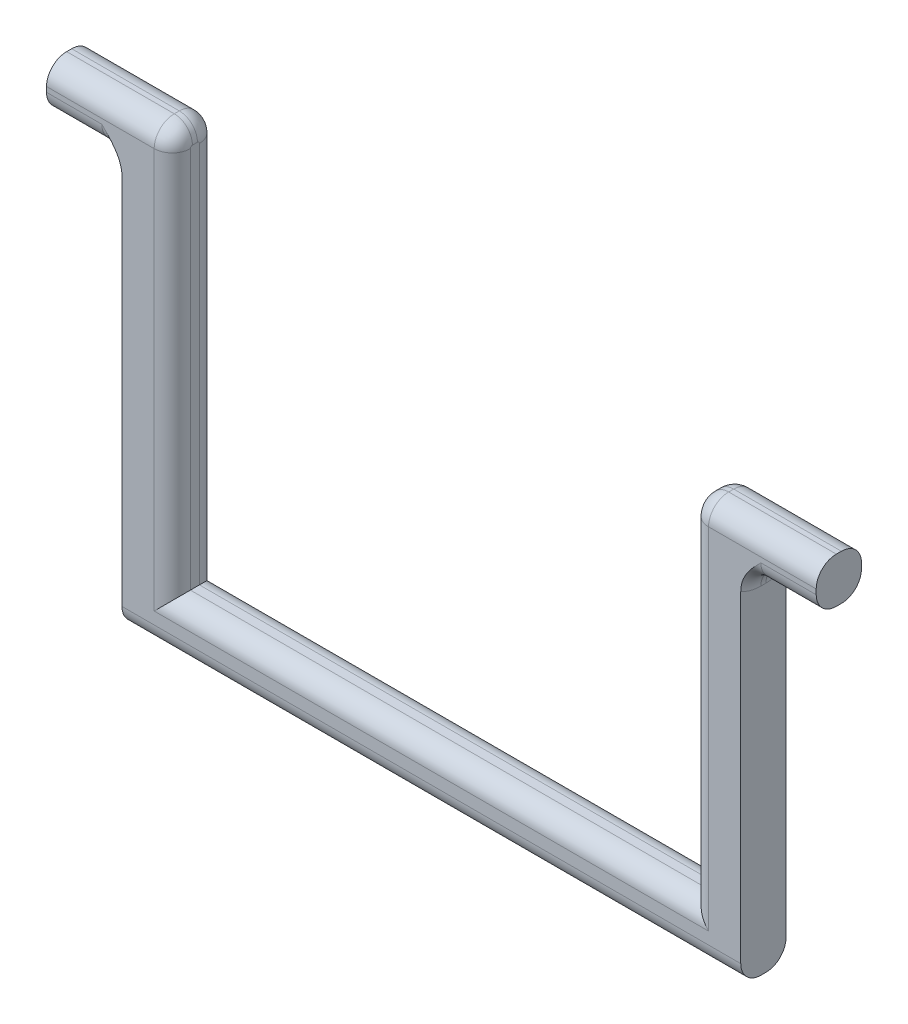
SolidWorks part; units mm, degrees
ref_plane "Front Plane" through (0, 0, 0) normal (0, 0, 1) x (1, 0, 0)
ref_plane "Top Plane" through (0, 0, 0) normal (0, 1, 0) x (1, 0, 0)
ref_plane "Right Plane" through (0, 0, 0) normal (1, 0, 0) x (0, 0, -1)
sketch "Sketch1" plane through (0, 0, 0) normal (0, 0, 1) x (1, 0, 0)
  line L0 (0, 0) -> (0, 11.43)
  line L1 (0, 11.43) -> (31.75, 11.43)
  line L2 (31.75, 11.43) -> (31.75, -90.17)
  line L9 (175.26, -102.87) -> (19.05, -102.87)
  line L10 (19.05, -102.87) -> (19.05, 0)
  line L11 (19.05, 0) -> (0, 0)
  line L13 (162.56, -90.17) -> (31.75, -90.17)
  line L14 (162.56, -90.17) -> (162.56, -1.27)
  line L15 (162.56, -1.27) -> (194.31, -1.27)
  line L16 (194.31, -1.27) -> (194.31, -12.7)
  line L17 (194.31, -12.7) -> (175.26, -12.7)
  line L18 (175.26, -12.7) -> (175.26, -102.87)
  dimension "D1" = 88.9
  dimension "D2" = 11.43
  dimension "1.5" = 31.75
  dimension "D3" = 31.75
  dimension "D4" = 156.21
  dimension "D5" = 12.7
  dimension "D6" = 12.7
  dimension "D7" = 101.6
  dimension ".45" = 11.43
  dimension "D8" = 12.7
extrude "Boss-Extrude1" add sketch "Sketch1" along normal blind 11.43
fillet "Fillet4" radius 5.08 8 edges at (9.525, 0, 11.43) (15.875, 11.43, 0) (15.875, 11.43, 11.43) (9.525, 0, 0) (184.785, -12.7, 0) (184.785, -12.7, 11.43) (178.435, -1.27, 0) (178.435, -1.27, 11.43)
fillet "Fillet5" radius 4.572 12 edges at (31.75, 11.43, 5.715) (31.75, 9.9421, 1.4879) (31.75, 9.9421, 9.9421) (162.56, -48.26, 0) (31.75, -41.91, 0) (162.56, -48.26, 11.43) (31.75, -41.91, 11.43) (97.155, -90.17, 0) (97.155, -90.17, 11.43) (162.56, -1.27, 5.715) (162.56, -2.7579, 1.4879) (162.56, -2.7579, 9.9421)
fillet "Fillet8" radius 5.08 2 edges at (97.155, -102.87, 0) (97.155, -102.87, 11.43)
fillet "Fillet9" radius 5.08 6 edges at (19.05, 0, 5.715) (19.05, 1.4879, 9.9421) (19.05, 1.4879, 1.4879) (175.26, -11.2121, 9.9421) (175.26, -12.7, 5.715) (175.26, -11.2121, 1.4879)
